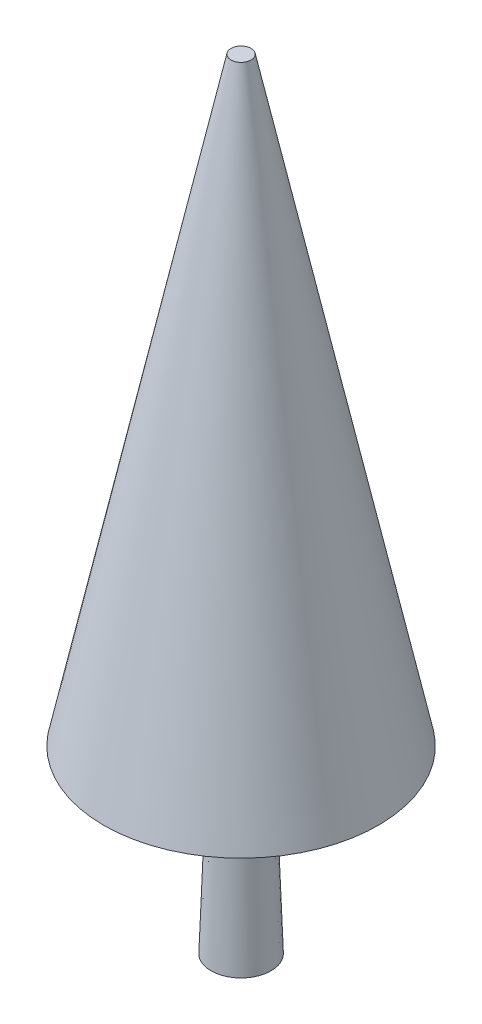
SolidWorks part; units mm, degrees
ref_plane "Plan de face" through (0, 0, 0) normal (0, 0, 1) x (1, 0, 0)
ref_plane "Plan de dessus" through (0, 0, 0) normal (0, 1, 0) x (1, 0, 0)
ref_plane "Plan de droite" through (0, 0, 0) normal (1, 0, 0) x (0, 0, -1)
sketch "Esquisse1" plane through (0, 0, 0) normal (0, 1, 0) x (1, 0, 0)
  circle A0 centre (0, 0) radius 500
  dimension "D1" = 1000
extrude "Boss.-Extru.1" add sketch "Esquisse1" along normal blind 3000 draft 2
sketch "Esquisse2" plane through (0, 3000, 0) normal (0, 1, 0) x (1, 0, 0)
  circle A0 centre (0, 0) radius 2293.114
extrude "Boss.-Extru.2" add sketch "Esquisse2" along normal blind 10000 draft 12
